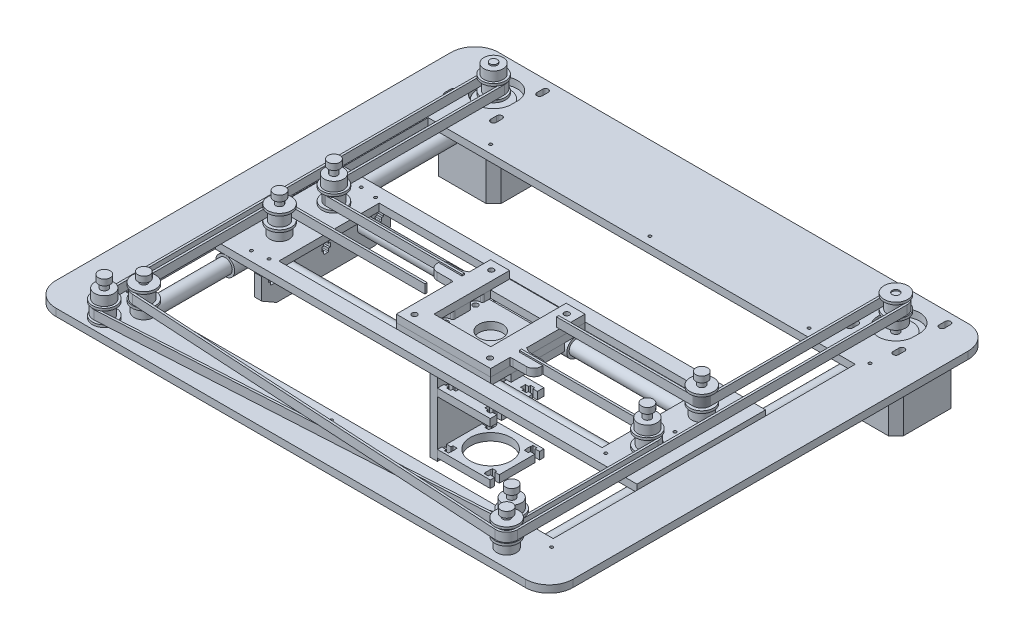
SolidWorks part; units mm, degrees
ref_plane "Front Plane" through (0, 0, 0) normal (0, 0, 1) x (1, 0, 0)
ref_plane "Top Plane" through (0, 0, 0) normal (0, 1, 0) x (1, 0, 0)
ref_plane "Right Plane" through (0, 0, 0) normal (1, 0, 0) x (0, 0, -1)
sketch "Sketch1" plane through (0, 0, 0) normal (0, 1, 0) x (1, 0, 0)
  line L0 (0, 101.6) -> (0, -101.6) construction
  line L1 (-143.7, 101.6) -> (143.7, 101.6)
  line L2 (-143.7, 101.6) -> (-143.7, -101.6)
  line L3 (-143.7, -101.6) -> (143.7, -101.6)
  line L4 (143.7, 101.6) -> (143.7, -101.6)
  line L5 (-143.7, 0) -> (143.7, 0) construction
  line L6 (-135.35, 158.3) -> (-135.35, 116.3) construction
  line L7 (-31.75, 31.75) -> (31.75, 31.75)
  line L8 (-31.75, 31.75) -> (-31.75, -31.75)
  line L9 (-31.75, -31.75) -> (31.75, -31.75)
  line L10 (31.75, 31.75) -> (31.75, -31.75)
  line L11 (-156.35, 158.3) -> (-114.35, 158.3)
  line L12 (-156.35, 158.3) -> (-156.35, 116.3)
  line L13 (-156.35, 116.3) -> (-114.35, 116.3)
  line L14 (-114.35, 158.3) -> (-114.35, 116.3)
  line L15 (-156.35, 137.3) -> (-114.35, 137.3) construction
  line L16 (-129.55, 137.3) -> (-129.55, -109.6) construction
  line L17 (-150.85, 152.8) -> (-119.85, 152.8) construction
  line L18 (-150.85, 152.8) -> (-150.85, 121.8) construction
  line L19 (-150.85, 121.8) -> (-119.85, 121.8) construction
  line L20 (-119.85, 152.8) -> (-119.85, 121.8) construction
  line L21 (-141.15, 137.3) -> (-141.15, -124.6) construction
  line L22 (-123.75, 12.5) -> (-31.75, 12.5)
  line L23 (-123.75, -12.5) -> (-31.75, -12.5)
  line L24 (-135.35, 114.3) -> (-135.35, -114.3) construction
  line L25 (-140.1125, 114.3) -> (-130.5875, 114.3)
  line L26 (-140.1125, 114.3) -> (-140.1125, -114.3)
  line L27 (-140.1125, -114.3) -> (-130.5875, -114.3)
  line L28 (-130.5875, 114.3) -> (-130.5875, -114.3)
  line L29 (-127, 25.8125) -> (127, 25.8125) construction
  line L30 (-141.7, 64.7344) -> (-129, 64.7344)
  line L31 (-141.7, 64.7344) -> (-141.7, 51.3835)
  line L32 (-141.7, 51.3835) -> (-129, 51.3835)
  line L33 (-129, 64.7344) -> (-129, 51.3835)
  line L34 (-127, 30.575) -> (127, 30.575)
  line L35 (-127, 30.575) -> (-127, 21.05)
  line L36 (-127, 21.05) -> (127, 21.05)
  line L37 (127, 30.575) -> (127, 21.05)
  line L38 (-115.75, 43.275) -> (-115.75, -43.275) construction
  line L39 (-108.75, 33.75) -> (108.75, 33.75)
  line L40 (-108.75, 33.75) -> (-108.75, -33.75)
  line L41 (-108.75, -33.75) -> (108.75, -33.75)
  line L42 (108.75, 33.75) -> (108.75, -33.75)
  line L43 (-141.7, 43.275) -> (141.7, 43.275)
  line L44 (-141.7, 43.275) -> (-141.7, -43.275)
  line L45 (-141.7, -43.275) -> (141.7, -43.275)
  line L46 (141.7, 43.275) -> (141.7, -43.275)
  line L48 (-174, 163.3) -> (174, 163.3)
  line L49 (-174, 163.3) -> (-174, -134.6)
  line L50 (-174, -134.6) -> (174, -134.6)
  line L51 (174, 163.3) -> (174, -134.6)
  circle A0 centre (-150.85, 152.8) radius 1.5
  circle A1 centre (-119.85, 152.8) radius 1.5
  circle A2 centre (-119.85, 121.8) radius 1.5
  circle A3 centre (-150.85, 121.8) radius 1.5
  circle A4 centre (-135.35, 137.3) radius 5.8
  circle A5 centre (-135.35, 137.3) radius 8
  circle A6 centre (-123.75, -109.6) radius 5.8
  circle A7 centre (-123.75, -109.6) radius 8
  circle A8 centre (-123.75, 18.3) radius 8
  circle A9 centre (-123.75, -18.3) radius 8
  circle A10 centre (-123.75, 18.3) radius 5.8
  circle A11 centre (-123.75, -18.3) radius 5.8
  circle A12 centre (-135.35, -124.6) radius 5.8
  circle A13 centre (-135.35, -124.6) radius 8
  circle A14 centre (0, 0) radius 19.05
  point P84 (-135.35, -132.6)
  point P85 (0, 19.05)
  point P86 (0, 21.05)
  dimension "D6" = 3
  dimension "D7" = 11.6
  dimension "D8" = 16
  dimension "D14" = 38.1
  dimension "D3" = 63.5
  dimension "D4" = 42
  dimension "D5" = 31
  dimension "D9" = 12.7
  dimension "D10" = 9.525
  dimension "D11" = 12.7
  dimension "D12" = 2
  dimension "D13" = 9.525
  dimension "D15" = 2
  dimension "D16" = 2
  dimension "D17" = 254
  dimension "D18" = 228.6
  dimension "D19" = 2
  dimension "D20" = 9.525
  dimension "D21" = 7
  dimension "D22" = 77
  dimension "D23" = 58.325
  dimension "D24" = 2
  dimension "D25" = 5
  dimension "D26" = 15
  dimension "D27" = 25
  dimension "D28" = 348
  dimension "D29" = 2
sketch "Sketch2" plane through (0, 0, 0) normal (0, 1, 0) x (1, 0, 0)
  line L1 (-174, 163.3) -> (174, 163.3)
  line L2 (-174, 163.3) -> (-174, -134.6)
  line L3 (-174, -134.6) -> (174, -134.6)
  line L4 (174, 163.3) -> (174, -134.6)
  line L5 (-143.7, 101.6) -> (143.7, 101.6)
  line L6 (-143.7, 101.6) -> (-143.7, -101.6)
  line L7 (-143.7, -101.6) -> (143.7, -101.6)
  line L8 (143.7, 101.6) -> (143.7, -101.6)
extrude "Extrude1" add sketch "Sketch2" along normal blind 4.9
sketch "Sketch3" plane through (0, 0, 0) normal (0, -1, 0) x (1, 0, 0)
  line L0 (-156.35, -158.3) -> (-114.35, -158.3) construction
  line L1 (-114.35, -158.3) -> (-114.35, -116.3) construction
  line L2 (-156.35, -116.3) -> (-114.35, -116.3) construction
  line L3 (-156.35, -158.3) -> (-156.35, -116.3) construction
  line L4 (-151.35, -158.3) -> (-119.35, -158.3)
  line L5 (-114.35, -153.3) -> (-114.35, -121.3)
  line L6 (-151.35, -116.3) -> (-119.35, -116.3)
  line L7 (-156.35, -153.3) -> (-156.35, -121.3)
  line L8 (-156.35, -121.3) -> (-151.35, -116.3)
  line L9 (-119.35, -116.3) -> (-114.35, -121.3)
  line L10 (-119.35, -158.3) -> (-114.35, -153.3)
  line L11 (-151.35, -158.3) -> (-156.35, -153.3)
  circle A0 centre (-150.85, -152.8) radius 1.5 construction
  circle A1 centre (-119.85, -152.8) radius 1.5 construction
  circle A2 centre (-119.85, -121.8) radius 1.5 construction
  circle A3 centre (-150.85, -121.8) radius 1.5 construction
  circle A4 centre (-150.85, -152.8) radius 1.5
  circle A5 centre (-119.85, -152.8) radius 1.5
  circle A6 centre (-119.85, -121.8) radius 1.5
  circle A7 centre (-150.85, -121.8) radius 1.5
  dimension "D3" = 5
  dimension "D4" = 5
  dimension "D5" = 5
  dimension "D6" = 5
extrude "Extrude2" add sketch "Sketch3" along normal blind 40.386 separate body
sketch "Sketch5" plane through (0, 0, 0) normal (0, 1, 0) x (1, 0, 0)
  circle A0 centre (-135.35, 137.3) radius 11
  dimension "D1" = 22
extrude "Extrude3" add sketch "Sketch5" along normal blind 1.9812
sketch "Sketch6" plane through (0, 1.9812, 0) normal (0, 1, 0) x (1, 0, 0)
  line L0 (-156.35, 137.3) -> (-114.35, 137.3) construction
  circle A0 centre (-135.35, 137.3) radius 2.5
  dimension "D1" = 5
extrude "Extrude4" add sketch "Sketch6" along normal offset from surface (21.8948 mm away) 23.876
mirror "Mirror1" about plane through (0, 0, 0) normal (1, 0, 0)
sketch "Sketch4" plane through (0, 4.9, 0) normal (0, 1, 0) x (1, 0, 0)
  line L0 (-150.85, 152.8) -> (-150.85, 156.8) construction
  line L1 (-152.725, 152.8) -> (-152.725, 156.8)
  line L2 (-148.975, 152.8) -> (-148.975, 156.8)
  line L3 (-119.85, 152.8) -> (-119.85, 156.8) construction
  line L4 (-121.725, 152.8) -> (-121.725, 156.8)
  line L5 (-117.975, 152.8) -> (-117.975, 156.8)
  line L6 (-150.85, 121.8) -> (-150.85, 125.8) construction
  line L7 (-152.725, 121.8) -> (-152.725, 125.8)
  line L8 (-148.975, 121.8) -> (-148.975, 125.8)
  line L9 (-119.85, 121.8) -> (-119.85, 125.8) construction
  line L10 (-121.725, 121.8) -> (-121.725, 125.8)
  line L11 (-117.975, 121.8) -> (-117.975, 125.8)
  line L12 (-135.35, 137.3) -> (-135.35, 141.3) construction
  line L13 (-147.35, 137.3) -> (-147.35, 141.3)
  line L14 (-123.35, 137.3) -> (-123.35, 141.3)
  line L15 (119.85, 152.8) -> (119.85, 156.8) construction
  line L16 (117.975, 152.8) -> (117.975, 156.8)
  line L17 (121.725, 152.8) -> (121.725, 156.8)
  line L18 (150.85, 152.8) -> (150.85, 156.8) construction
  line L19 (148.975, 152.8) -> (148.975, 156.8)
  line L20 (152.725, 152.8) -> (152.725, 156.8)
  line L21 (150.85, 121.8) -> (150.85, 125.8) construction
  line L22 (148.975, 121.8) -> (148.975, 125.8)
  line L23 (152.725, 121.8) -> (152.725, 125.8)
  line L24 (119.85, 121.8) -> (119.85, 125.8) construction
  line L25 (117.975, 121.8) -> (117.975, 125.8)
  line L26 (121.725, 121.8) -> (121.725, 125.8)
  line L27 (135.35, 137.3) -> (135.35, 141.3) construction
  line L28 (123.35, 137.3) -> (123.35, 141.3)
  line L29 (147.35, 137.3) -> (147.35, 141.3)
  arc A0 (-152.725, 152.8) -> (-148.975, 152.8) centre (-150.85, 152.8) ccw
  arc A1 (-148.975, 156.8) -> (-152.725, 156.8) centre (-150.85, 156.8) ccw
  arc A2 (-121.725, 152.8) -> (-117.975, 152.8) centre (-119.85, 152.8) ccw
  arc A3 (-117.975, 156.8) -> (-121.725, 156.8) centre (-119.85, 156.8) ccw
  arc A4 (-152.725, 121.8) -> (-148.975, 121.8) centre (-150.85, 121.8) ccw
  arc A5 (-148.975, 125.8) -> (-152.725, 125.8) centre (-150.85, 125.8) ccw
  arc A6 (-121.725, 121.8) -> (-117.975, 121.8) centre (-119.85, 121.8) ccw
  arc A7 (-117.975, 125.8) -> (-121.725, 125.8) centre (-119.85, 125.8) ccw
  arc A8 (-147.35, 137.3) -> (-123.35, 137.3) centre (-135.35, 137.3) ccw
  arc A9 (-123.35, 141.3) -> (-147.35, 141.3) centre (-135.35, 141.3) ccw
  arc A10 (117.975, 152.8) -> (121.725, 152.8) centre (119.85, 152.8) ccw
  arc A11 (121.725, 156.8) -> (117.975, 156.8) centre (119.85, 156.8) ccw
  arc A12 (148.975, 152.8) -> (152.725, 152.8) centre (150.85, 152.8) ccw
  arc A13 (152.725, 156.8) -> (148.975, 156.8) centre (150.85, 156.8) ccw
  arc A14 (148.975, 121.8) -> (152.725, 121.8) centre (150.85, 121.8) ccw
  arc A15 (152.725, 125.8) -> (148.975, 125.8) centre (150.85, 125.8) ccw
  arc A16 (117.975, 121.8) -> (121.725, 121.8) centre (119.85, 121.8) ccw
  arc A17 (121.725, 125.8) -> (117.975, 125.8) centre (119.85, 125.8) ccw
  arc A18 (123.35, 137.3) -> (147.35, 137.3) centre (135.35, 137.3) ccw
  arc A19 (147.35, 141.3) -> (123.35, 141.3) centre (135.35, 141.3) ccw
  point P3 (-150.85, 154.8)
  point P10 (-119.85, 154.8)
  point P21 (-150.85, 123.8)
  point P34 (-119.85, 123.8)
  point P45 (-135.35, 139.3)
  point P50 (119.85, 154.8)
  point P58 (150.85, 154.8)
  point P66 (150.85, 123.8)
  point P74 (119.85, 123.8)
  point P82 (135.35, 139.3)
  dimension "D1" = 3.75
  dimension "D2" = 4
  dimension "D3" = 24
extrude "Extrude5" cut sketch "Sketch4" against normal through all
sketch "Sketch7" plane through (0, 0, 0) normal (0, 0, 1) x (1, 0, 0)
  line L0 (-140.1125, 0) -> (-130.5875, 0) construction
  line L1 (-140.1125, 0) -> (-130.5875, 0) construction
  line L2 (0, 0) -> (0, 47.5077) construction
  line L3 (-135.35, 0) -> (-135.35, -4.7625) construction
  line L4 (-174, 0) -> (174, 0) construction
  circle A0 centre (-135.35, -4.7625) radius 4.7625
  circle A1 centre (135.35, -4.7625) radius 4.7625
  dimension "D1" = 9.525
  dimension "D2" = 4.7625
extrude "Extrude6" add sketch "Sketch7" along normal mid plane 228.6 separate body
sketch "Sketch8" plane through (0, 0, 0) normal (0, 0, 1) x (1, 0, 0)
  circle A0 centre (135.35, -4.7625) radius 6.35
  circle A1 centre (135.35, -4.7625) radius 4.7625 construction
  circle A2 centre (135.35, -4.7625) radius 4.7625
  dimension "D1" = 12.7
extrude "Extrude7" add sketch "Sketch8" along normal mid plane 12.7 separate body
sketch "Sketch9" plane through (0, 0, 6.35) normal (0, 0, 1) x (1, 0, 0)
  line L0 (135.35, -4.7625) -> (135.35, 1.5875) construction
  circle A0 centre (135.35, -4.7625) radius 6.35 construction
ref_plane "Plane1" through (0, 1.5875, 0) normal (0, 1, 0) x (-1, 0, 0)
sketch "Sketch10" plane through (0, 1.5875, 0) normal (0, 1, 0) x (-1, 0, 0)
  line L0 (141.7, -43.275) -> (141.7, 43.275) construction
  line L1 (141.7, -43.275) -> (-141.7, -43.275) construction
  line L2 (-141.7, -43.275) -> (-141.7, 43.275) construction
  line L3 (141.7, 43.275) -> (-141.7, 43.275) construction
  line L4 (141.7, -43.275) -> (141.7, 43.275)
  line L5 (141.7, -43.275) -> (-141.7, -43.275)
  line L6 (-141.7, -43.275) -> (-141.7, 43.275)
  line L7 (141.7, 43.275) -> (-141.7, 43.275)
  line L8 (108.75, -33.75) -> (108.75, 33.75) construction
  line L9 (108.75, -33.75) -> (-108.75, -33.75) construction
  line L10 (-108.75, -33.75) -> (-108.75, 33.75) construction
  line L11 (108.75, 33.75) -> (-108.75, 33.75) construction
  line L12 (108.75, -33.75) -> (108.75, 33.75)
  line L13 (108.75, -33.75) -> (-108.75, -33.75)
  line L14 (-108.75, -33.75) -> (-108.75, 33.75)
  line L15 (108.75, 33.75) -> (-108.75, 33.75)
extrude "Extrude8" add sketch "Sketch10" along normal blind 4.9 separate body
sketch "Sketch11" plane through (0, 0, 43.275) normal (0, 0, 1) x (1, 0, 0)
  circle A0 centre (-135.35, -4.7625) radius 6.35
  circle A1 centre (-135.35, -4.7625) radius 4.7625 construction
  circle A2 centre (-135.35, -4.7625) radius 4.7625
  dimension "D1" = 12.7
extrude "Extrude9" add sketch "Sketch11" against normal blind 12.7 separate body
sketch "Sketch12" plane through (0, 0, -43.275) normal (0, 0, -1) x (-1, 0, 0)
  circle A0 centre (135.35, -4.7625) radius 4.7625 construction
  circle A1 centre (135.35, -4.7625) radius 6.35
  circle A2 centre (135.35, -4.7625) radius 6.35
  circle A3 centre (135.35, -4.7625) radius 4.7625
  dimension "D1" = 0
extrude "Extrude10" add sketch "Sketch12" against normal blind 12.7 separate body
sketch "Sketch13" plane through (0, 0, 0) normal (1, 0, 0) x (0, 0, -1)
  line L0 (30.575, 0) -> (21.05, 0) construction
  line L1 (30.575, 0) -> (21.05, 0) construction
  line L2 (25.8125, 0) -> (25.8125, -25.9169) construction
  line L3 (-33.75, 1.5875) -> (33.75, 1.5875) construction
  line L4 (0, 0) -> (0, 47.9964) construction
  line L5 (43.275, 0) -> (-43.275, 0) construction
  circle A0 centre (25.8125, -3.175) radius 4.7625
  circle A1 centre (-25.8125, -3.175) radius 4.7625
  dimension "D1" = 9.525
  dimension "D2" = 4.7625
extrude "Extrude11" add sketch "Sketch13" along normal mid plane 254 separate body
sketch "Sketch14" plane through (0, 0, 0) normal (1, 0, 0) x (0, 0, -1)
  circle A1 centre (-25.8125, -3.175) radius 6.35
  circle A2 centre (-25.8125, -3.175) radius 4.7625
  circle A3 centre (-25.8125, -3.175) radius 4.7625
  dimension "D3" = 12.7
  dimension "D1" = 0
extrude "Extrude12" add sketch "Sketch14" along normal mid plane 12.7 separate body
sketch "Sketch15" plane through (6.35, 0, 0) normal (1, 0, 0) x (0, 0, -1)
  line L0 (-25.8125, -3.175) -> (-25.8125, 3.175) construction
  circle A0 centre (-25.8125, -3.175) radius 6.35 construction
  circle A1 centre (-25.8125, -3.175) radius 6.35 construction
ref_plane "Plane2" through (0, 3.175, 0) normal (0, 1, 0) x (-1, 0, 0)
sketch "Sketch16" plane through (0, 3.175, 0) normal (0, 1, 0) x (-1, 0, 0)
  line L0 (31.75, -31.75) -> (-31.75, -31.75) construction
  line L1 (31.75, -31.75) -> (31.75, 31.75) construction
  line L2 (31.75, 31.75) -> (-31.75, 31.75) construction
  line L3 (-31.75, -31.75) -> (-31.75, 31.75) construction
  line L4 (31.75, -31.75) -> (-31.75, -31.75)
  line L5 (31.75, -31.75) -> (31.75, 31.75)
  line L6 (31.75, 31.75) -> (-31.75, 31.75)
  line L7 (-31.75, -31.75) -> (-31.75, 31.75)
  line L9 (-19.05, 19.05) -> (19.05, 19.05)
  line L10 (-19.05, 19.05) -> (-19.05, -19.05)
  line L11 (-19.05, -19.05) -> (19.05, -19.05)
  line L12 (19.05, 19.05) -> (19.05, -19.05)
  circle A0 centre (0, 0) radius 19.05 construction
  circle A1 centre (0, 0) radius 19.05 construction
extrude "Extrude13" add sketch "Sketch16" along normal blind 4.9 separate body
sketch "Sketch17" plane through (31.75, 0, 0) normal (1, 0, 0) x (0, 0, -1)
  circle A0 centre (25.8125, -3.175) radius 4.7625 construction
  circle A1 centre (25.8125, -3.175) radius 4.7625
  circle A2 centre (25.8125, -3.175) radius 6.35
  dimension "D1" = 12.7
extrude "Extrude14" add sketch "Sketch17" against normal blind 12.7 separate body
sketch "Sketch18" plane through (-31.75, 0, 0) normal (-1, 0, 0) x (0, 0, 1)
  circle A0 centre (-25.8125, -3.175) radius 6.35 construction
  circle A1 centre (-25.8125, -3.175) radius 6.35
  circle A2 centre (-25.8125, -3.175) radius 4.7625 construction
  circle A3 centre (-25.8125, -3.175) radius 4.7625
extrude "Extrude15" add sketch "Sketch18" against normal blind 12.7 separate body
sketch "Sketch19" plane through (0, 6.4875, 0) normal (0, 1, 0) x (1, 0, 0)
  line L1 (0, 43.275) -> (0, -43.275) construction
  line L2 (-141.7, 43.275) -> (141.7, 43.275) construction
  line L3 (-141.7, -43.275) -> (141.7, -43.275) construction
  circle A0 centre (-123.75, 18.3) radius 1
  circle A1 centre (-123.75, -18.3) radius 1
  circle A2 centre (123.75, -18.3) radius 1
  circle A3 centre (123.75, 18.3) radius 1
  dimension "D1" = 2
extrude "Extrude16" cut sketch "Sketch19" against normal through all
sketch "Sketch20" plane through (0, 6.4875, 0) normal (0, 1, 0) x (1, 0, 0)
  circle A0 centre (-123.75, 18.3) radius 2.5
  circle A1 centre (-123.75, -18.3) radius 2.5
  circle A2 centre (123.75, 18.3) radius 2.5
  circle A3 centre (123.75, -18.3) radius 2.5
  dimension "D1" = 5
extrude "Extrude17" add sketch "Sketch20" along normal blind 22 separate body
sketch "Sketch21" plane through (0, 28.4875, 0) normal (0, 1, 0) x (1, 0, 0)
  circle A0 centre (-123.75, 18.3) radius 4
  circle A1 centre (-123.75, -18.3) radius 4
  circle A2 centre (123.75, 18.3) radius 4
  circle A3 centre (123.75, -18.3) radius 4
  dimension "D1" = 8
extrude "Extrude18" add sketch "Sketch21" along normal blind 4
sketch "Sketch22" plane through (0, 6.4875, 0) normal (0, 1, 0) x (1, 0, 0)
  circle A0 centre (-123.75, 18.3) radius 2.5
  circle A1 centre (-123.75, 18.3) radius 8
  dimension "D1" = 5
  dimension "D2" = 16
extrude "Extrude19" add sketch "Sketch22" along normal blind 1.6 separate body
sketch "Sketch23" plane through (0, 8.0875, 0) normal (0, 1, 0) x (1, 0, 0)
  circle A0 centre (-123.75, 18.3) radius 2.5 construction
  circle A1 centre (-123.75, 18.3) radius 2.5
  circle A2 centre (-123.75, 18.3) radius 5.8
  dimension "D1" = 11.6
extrude "Extrude20" add sketch "Sketch23" along normal blind 8
sketch "Sketch24" plane through (0, 16.0875, 0) normal (0, 1, 0) x (1, 0, 0)
  circle A0 centre (-123.75, 18.3) radius 2.5 construction
  circle A1 centre (-123.75, 18.3) radius 8
  circle A2 centre (-123.75, 18.3) radius 8
  circle A3 centre (-123.75, 18.3) radius 2.5
  dimension "D1" = 0
extrude "Extrude21" add sketch "Sketch24" along normal blind 1.6
sketch "Sketch25" plane through (0, 17.6875, 0) normal (0, 1, 0) x (1, 0, 0)
  circle A0 centre (-123.75, 18.3) radius 2.5 construction
  circle A1 centre (-123.75, 18.3) radius 2.5
  circle A2 centre (-123.75, 18.3) radius 6.5
  dimension "D1" = 13
extrude "Extrude22" add sketch "Sketch25" along normal offset from surface (6.3 mm away) 17.5
sketch "Sketch26" plane through (0, 4.9, 0) normal (0, 1, 0) x (1, 0, 0)
  line L1 (0, -101.6) -> (0, 0) construction
  line L2 (-143.7, -101.6) -> (143.7, -101.6) construction
  circle A0 centre (-123.75, -109.6) radius 1
  circle A1 centre (-135.35, -124.6) radius 1
  circle A2 centre (135.35, -124.6) radius 1
  circle A3 centre (123.75, -109.6) radius 1
  dimension "D1" = 2
extrude "Extrude23" cut sketch "Sketch26" against normal through all
sketch "Sketch27" plane through (0, 4.9, 0) normal (0, 1, 0) x (1, 0, 0)
  circle A0 centre (-123.75, -109.6) radius 2.5
  circle A1 centre (-135.35, -124.6) radius 2.5
  circle A2 centre (123.75, -109.6) radius 2.5
  circle A3 centre (135.35, -124.6) radius 2.5
  dimension "D1" = 5
extrude "Extrude24" add sketch "Sketch27" along normal blind 22 separate body
sketch "Sketch28" plane through (0, 26.9, 0) normal (0, 1, 0) x (1, 0, 0)
  circle A0 centre (-123.75, -109.6) radius 4
  circle A1 centre (-135.35, -124.6) radius 4
  circle A2 centre (123.75, -109.6) radius 4
  circle A3 centre (135.35, -124.6) radius 4
  dimension "D1" = 8
extrude "Extrude25" add sketch "Sketch28" along normal blind 4
move or copy body "Body-Move/Copy1" bodies to move or copy 131
move or copy body "Body-Move/Copy2" bodies to move or copy 141 placed by mates yes
other "Distance2" parameters "D1"=7
move or copy body "Body-Move/Copy3" bodies to move or copy 142 placed by mates yes
move or copy body "Body-Move/Copy4" bodies to move or copy 143 placed by mates yes
move or copy body "Body-Move/Copy5" bodies to move or copy 144 placed by mates yes
move or copy body "Body-Move/Copy6" bodies to move or copy 145 placed by mates yes
other "Distance3" parameters "D1"=7
move or copy body "Body-Move/Copy7" bodies to move or copy 146 placed by mates yes
move or copy body "Body-Move/Copy8" bodies to move or copy 147 placed by mates yes
move or copy body "Body-Move/Copy9" bodies to move or copy 148 placed by mates yes
move or copy body "Body-Move/Copy10" bodies to move or copy 149 placed by mates yes
sketch "Sketch29" plane through (0, 8.0875, 0) normal (0, 1, 0) x (1, 0, 0)
  line L0 (-129.55, 137.3) -> (-129.55, 18.3)
  line L1 (-123.75, 12.5) -> (-31.75, 12.5)
  line L2 (-141.15, 137.3) -> (-141.15, -124.6)
  line L3 (-135.0148, -130.3903) -> (124.0852, -115.3903)
  line L4 (129.55, -18.3) -> (129.55, -109.6)
  line L5 (123.75, -12.5) -> (31.75, -12.5)
  line L6 (31.75, 31.75) -> (31.75, -31.75) construction
  line L7 (-135.35, 158.3) -> (-135.35, 116.3) construction
  line L8 (-156.35, 137.3) -> (-114.35, 137.3) construction
  line L9 (-123.75, 14) -> (-31.75, 14)
  line L11 (-128.05, 137.3) -> (-128.05, 18.3)
  line L12 (-142.65, 137.3) -> (-142.65, -124.6)
  line L13 (-134.9281, -131.8878) -> (124.1719, -116.8878)
  line L14 (131.05, -18.3) -> (131.05, -109.6)
  line L15 (123.75, -11) -> (31.75, -11)
  line L16 (-31.75, 14) -> (-31.75, 12.5)
  line L17 (31.75, -11) -> (31.75, -12.5)
  circle A0 centre (-123.75, 18.3) radius 5.8 construction
  circle A1 centre (-135.35, -124.6) radius 5.8 construction
  circle A2 centre (123.75, -109.6) radius 5.8 construction
  circle A3 centre (123.75, -18.3) radius 5.8 construction
  circle A4 centre (-135.35, -124.6) radius 5.8 construction
  arc A5 (-141.15, 137.3) -> (-129.55, 137.3) centre (-135.35, 137.3) cw
  arc A6 (-129.55, 18.3) -> (-123.75, 12.5) centre (-123.75, 18.3) ccw
  arc A7 (-141.15, -124.6) -> (-135.0148, -130.3903) centre (-135.35, -124.6) ccw
  arc A8 (124.0852, -115.3903) -> (129.55, -109.6) centre (123.75, -109.6) ccw
  arc A9 (129.55, -18.3) -> (123.75, -12.5) centre (123.75, -18.3) ccw
  arc A10 (-128.05, 18.3) -> (-123.75, 14) centre (-123.75, 18.3) ccw
  arc A11 (-142.65, 137.3) -> (-128.05, 137.3) centre (-135.35, 137.3) cw
  arc A12 (-142.65, -124.6) -> (-134.9281, -131.8878) centre (-135.35, -124.6) ccw
  arc A13 (124.1719, -116.8878) -> (131.05, -109.6) centre (123.75, -109.6) ccw
  arc A14 (131.05, -18.3) -> (123.75, -11) centre (123.75, -18.3) ccw
  dimension "D1" = 1.5
extrude "Extrude26" add sketch "Sketch29" along normal blind 6 separate body
sketch "Sketch30" plane through (0, 15.0875, 0) normal (0, 1, 0) x (1, 0, 0)
  line L0 (129.55, 137.3) -> (129.55, 18.3)
  line L1 (123.75, 12.5) -> (31.75, 12.5)
  line L2 (31.75, 31.75) -> (31.75, -31.75) construction
  line L3 (141.15, 137.3) -> (141.15, -124.6)
  line L4 (135.0148, -130.3903) -> (-124.0852, -115.3903)
  line L5 (-129.55, -109.6) -> (-129.55, -18.3)
  line L6 (-129.55, 137.3) -> (-129.55, -109.6) construction
  line L7 (-123.75, -12.5) -> (-31.75, -12.5)
  line L8 (-123.75, -11) -> (-31.75, -11)
  line L9 (-131.05, -109.6) -> (-131.05, -18.3)
  line L10 (134.9281, -131.8878) -> (-124.1719, -116.8878)
  line L11 (142.65, 137.3) -> (142.65, -124.6)
  line L12 (128.05, 137.3) -> (128.05, 18.3)
  line L13 (123.75, 14) -> (31.75, 14)
  line L14 (-31.75, -11) -> (-31.75, -12.5)
  line L15 (31.75, 14) -> (31.75, 12.5)
  circle A0 centre (135.35, 137.3) radius 5.8 construction
  circle A1 centre (123.75, 18.3) radius 5.8 construction
  circle A2 centre (135.35, -124.6) radius 5.8 construction
  circle A3 centre (-123.75, -109.6) radius 5.8 construction
  circle A4 centre (-123.75, -18.3) radius 5.8 construction
  circle A5 centre (-123.75, -109.6) radius 5.8 construction
  arc A6 (141.15, 137.3) -> (129.55, 137.3) centre (135.35, 137.3) ccw
  arc A7 (123.75, 12.5) -> (129.55, 18.3) centre (123.75, 18.3) ccw
  arc A8 (135.0148, -130.3903) -> (141.15, -124.6) centre (135.35, -124.6) ccw
  arc A9 (-124.0852, -115.3903) -> (-129.55, -109.6) centre (-123.75, -109.6) cw
  arc A10 (-129.55, -18.3) -> (-123.75, -12.5) centre (-123.75, -18.3) cw
  arc A11 (-131.05, -18.3) -> (-123.75, -11) centre (-123.75, -18.3) cw
  arc A12 (-124.1719, -116.8878) -> (-131.05, -109.6) centre (-123.75, -109.6) cw
  arc A13 (134.9281, -131.8878) -> (142.65, -124.6) centre (135.35, -124.6) ccw
  arc A14 (142.65, 137.3) -> (128.05, 137.3) centre (135.35, 137.3) ccw
  arc A15 (123.75, 14) -> (128.05, 18.3) centre (123.75, 18.3) ccw
  dimension "D1" = 1.5
extrude "Extrude28" add sketch "Sketch30" along normal blind 6 separate body
fillet "Fillet1" radius 16 4 edges at (174, 2.45, -163.3) (174, 2.45, 134.6) (-174, 2.45, 134.6) (-174, 2.45, -163.3)
sketch "Sketch31" plane through (0, 0, 0) normal (0, -1, 0) x (1, 0, 0)
  line L0 (0, 134.6) -> (0, -163.3) construction
  line L1 (-155.1125, 109.6) -> (155.1125, 109.6) construction
  line L2 (-155.1125, 109.6) -> (-155.1125, 104.6) construction
  line L3 (-155.1125, 104.6) -> (155.1125, 104.6) construction
  line L4 (155.1125, 109.6) -> (155.1125, 104.6) construction
  line L5 (-158, 134.6) -> (158, 134.6) construction
  line L6 (158, -163.3) -> (-158, -163.3) construction
  line L7 (-143.7, 101.6) -> (143.7, 101.6) construction
  line L8 (-140.1125, 114.3) -> (-140.1125, -114.3) construction
  line L9 (-155.1125, 107.1) -> (155.1125, 107.1) construction
  line L10 (-143.7, 0) -> (143.7, 0) construction
  line L11 (-143.7, -101.6) -> (-143.7, 101.6) construction
  line L12 (143.7, 101.6) -> (143.7, -101.6) construction
  circle A0 centre (-148.1125, 107.1) radius 1
  circle A1 centre (-107.1125, 107.1) radius 1
  circle A2 centre (0, 107.1) radius 1
  circle A3 centre (107.1125, 107.1) radius 1
  circle A4 centre (148.1125, 107.1) radius 1
  circle A5 centre (148.1125, -107.1) radius 1
  circle A6 centre (107.1125, -107.1) radius 1
  circle A7 centre (0, -107.1) radius 1
  circle A8 centre (-107.1125, -107.1) radius 1
  circle A9 centre (-148.1125, -107.1) radius 1
  circle A10 centre (-148.1125, 107.1) radius 3 construction
  dimension "D4" = 2
  dimension "D7" = 6
  dimension "D1" = 5
  dimension "D2" = 3
  dimension "D3" = 15
  dimension "D5" = 7
  dimension "D6" = 48
extrude "Extrude29" cut sketch "Sketch31" against normal through all
sketch "Sketch32" plane through (0, 1.5875, 0) normal (0, -1, 0) x (1, 0, 0)
  line L0 (0, 43.275) -> (0, -43.275) construction
  line L1 (-141.7, 43.275) -> (141.7, 43.275) construction
  line L2 (141.7, -43.275) -> (-141.7, -43.275) construction
  line L3 (-108.75, -33.75) -> (-108.75, 33.75) construction
  line L4 (-115.75, 43.275) -> (-110.75, 43.275) construction
  line L5 (-115.75, 43.275) -> (-115.75, -43.275) construction
  line L6 (-115.75, -43.275) -> (-110.75, -43.275) construction
  line L7 (-110.75, 43.275) -> (-110.75, -43.275) construction
  line L8 (-113.25, 43.275) -> (-113.25, -43.275) construction
  line L9 (-108.75, 0) -> (108.75, 0) construction
  line L10 (108.75, 33.75) -> (108.75, -33.75) construction
  line L15 (-127, 25.8125) -> (-102.3276, 25.8125) construction
  line L16 (-127, 30.575) -> (-127, 21.05) construction
  line L17 (-141.7, -36.925) -> (-124.05, -36.925) construction
  line L18 (-141.7, -30.575) -> (-141.7, -43.275) construction
  line L19 (-128.05, -18.3) -> (-128.05, -137.3) construction
  line L20 (-141.7, -34.425) -> (-116.7, -34.425) construction
  line L21 (-141.7, -34.425) -> (-141.7, -39.425) construction
  line L22 (-141.7, -39.425) -> (-116.7, -39.425) construction
  line L23 (-116.7, -34.425) -> (-116.7, -39.425) construction
  line L25 (124.05, 0) -> (141.7, 0) construction
  line L26 (141.7, 43.275) -> (141.7, -43.275) construction
  circle A0 centre (-113.25, 0) radius 1
  circle A1 centre (-113.25, 35.8125) radius 1
  circle A2 centre (-113.25, 35.8125) radius 3 construction
  circle A3 centre (-113.25, 0) radius 3 construction
  circle A4 centre (-113.25, -35.8125) radius 1
  circle A6 centre (113.25, -35.8125) radius 1
  circle A8 centre (113.25, 0) radius 1
  circle A9 centre (113.25, 35.8125) radius 1
  circle A10 centre (-124.05, -36.925) radius 1
  circle A11 centre (-124.05, -36.925) radius 3 construction
  circle A12 centre (-124.05, 36.925) radius 1
  circle A13 centre (124.05, 0) radius 1
  point P53 (-127.05, -36.925)
  dimension "D3" = 6
  dimension "D5" = 2
  dimension "D6" = 6
  dimension "D7" = 2
  dimension "D1" = 5
  dimension "D2" = 2
  dimension "D4" = 10
  dimension "D8" = 1
  dimension "D9" = 25
extrude "Extrude30" cut sketch "Sketch32" against normal through all
sketch "Sketch33" plane through (0, 8.075, 0) normal (0, 1, 0) x (1, 0, 0)
  line L0 (-19.05, -19.05) -> (19.05, -19.05) construction
  line L1 (19.05, -19.05) -> (19.05, 19.05) construction
  line L2 (-19.05, 19.05) -> (-19.05, -19.05) construction
  line L4 (-31.75, 31.75) -> (-31.75, -31.75)
  line L5 (-31.75, -31.75) -> (31.75, -31.75)
  line L6 (31.75, -31.75) -> (31.75, 31.75)
  line L7 (31.75, 31.75) -> (-31.75, 31.75)
  line L8 (-31.75, 31.75) -> (-31.75, -31.75)
  line L9 (-31.75, -31.75) -> (31.75, -31.75)
  line L10 (31.75, -31.75) -> (31.75, 31.75)
  line L11 (31.75, 31.75) -> (19.05, 31.75)
  line L12 (-19.05, -19.05) -> (19.05, -19.05)
  line L13 (19.05, -19.05) -> (19.05, 19.05)
  line L14 (-19.05, 19.05) -> (-19.05, -19.05)
  line L16 (-19.05, 19.05) -> (-19.05, 31.75)
  line L17 (19.05, 19.05) -> (19.05, 31.75)
  line L18 (-19.05, 31.75) -> (-31.75, 31.75)
  dimension "D1" = 0
extrude "Extrude31" add sketch "Sketch33" along normal blind 5 separate body
sketch "Sketch34" plane through (0, 13.075, 0) normal (0, 1, 0) x (1, 0, 0)
  line L0 (-25.4, 31.75) -> (-25.4, -31.75) construction
  line L1 (-19.05, 31.75) -> (-31.75, 31.75) construction
  line L2 (-31.75, -31.75) -> (31.75, -31.75) construction
  line L3 (0, -31.75) -> (0, 31.75) construction
  line L4 (31.75, 31.75) -> (-31.75, 31.75) construction
  line L5 (-31.75, 0) -> (31.75, 0) construction
  line L6 (-31.75, 31.75) -> (-31.75, -31.75) construction
  line L7 (31.75, -31.75) -> (31.75, 31.75) construction
  line L8 (-127, 25.8125) -> (127, 25.8125) construction
  line L9 (-127, 30.575) -> (-127, 21.05) construction
  line L10 (127, 21.05) -> (127, 30.575) construction
  circle A0 centre (-25.4, 25.8125) radius 1.75
  circle A1 centre (-25.4, -25.8125) radius 1.75
  circle A2 centre (25.4, -25.8125) radius 1.75
  circle A3 centre (25.4, 25.8125) radius 1.75
  dimension "D1" = 3.5
extrude "Extrude32" cut sketch "Sketch34" against normal through all
sketch "Sketch35" plane through (0, 8.075, 0) normal (0, 1, 0) x (1, 0, 0)
  circle A0 centre (-25.4, 25.8125) radius 0.875
  circle A1 centre (25.4, 25.8125) radius 0.875
  circle A2 centre (25.4, -25.8125) radius 0.875
  circle A3 centre (-25.4, -25.8125) radius 0.875
  dimension "D1" = 1.75
extrude "Extrude33" cut sketch "Sketch35" against normal through all
sketch "Sketch36" plane through (0, 3.175, 0) normal (0, -1, 0) x (1, 0, 0)
  line L0 (0, 0) -> (0, -31.75) construction
  line L1 (-19.05, 0) -> (19.05, 0) construction
  line L2 (-19.05, -19.05) -> (-19.05, 19.05) construction
  line L3 (19.05, 19.05) -> (19.05, -19.05) construction
  line L4 (-31.75, -31.75) -> (-31.75, 31.75) construction
  line L5 (31.75, -31.75) -> (-31.75, -31.75) construction
  line L6 (-31.75, 18.05) -> (31.75, 18.05)
  line L9 (-31.75, 18.05) -> (-31.75, -18.05)
  line L10 (-31.75, -18.05) -> (31.75, -18.05)
  line L11 (31.75, 18.05) -> (31.75, -18.05)
  line L12 (31.75, 31.75) -> (31.75, -31.75) construction
  line L13 (-19.05, 19.05) -> (19.05, 19.05) construction
  circle A0 centre (0, 0) radius 7.9756
  circle A1 centre (-27.75, 10) radius 1.75
  circle A2 centre (-27.75, -10) radius 1.75
  circle A3 centre (27.75, -10) radius 1.75
  circle A4 centre (27.75, 10) radius 1.75
  dimension "D2" = 15.9512
  dimension "D3" = 3.5
  dimension "D1" = 1
  dimension "D4" = 4
  dimension "D5" = 20
extrude "Extrude34" add sketch "Sketch36" along normal blind 5 separate body
sketch "Sketch37" plane through (0, 3.175, 0) normal (0, -1, 0) x (1, 0, 0)
  circle A0 centre (-27.75, 10) radius 0.875
  circle A1 centre (27.75, 10) radius 0.875
  circle A2 centre (27.75, -10) radius 0.875
  circle A3 centre (-27.75, -10) radius 0.875
  dimension "D1" = 1.75
extrude "Extrude35" cut sketch "Sketch37" against normal through all
ref_plane "Plane5" through (0, -7.825, 0) normal (0, -1, 0) x (1, 0, 0)
sketch "Sketch38" plane through (0, -7.825, 0) normal (0, -1, 0) x (1, 0, 0)
  line L0 (31.75, 18.05) -> (-31.75, 18.05) construction
  line L1 (-22.75, 18.05) -> (-17.75, 18.05) construction
  line L2 (-22.75, 18.05) -> (-22.75, -18.05) construction
  line L3 (-22.75, -18.05) -> (-17.75, -18.05) construction
  line L4 (-17.75, 18.05) -> (-17.75, -18.05) construction
  line L5 (-31.75, -18.05) -> (31.75, -18.05) construction
  line L6 (0, 0) -> (0, 26.54) construction
  line L8 (-17.75, 18.05) -> (17.75, 18.05)
  line L9 (-17.75, 18.05) -> (-17.75, -18.05)
  line L10 (-17.75, -18.05) -> (17.75, -18.05)
  line L11 (17.75, 18.05) -> (17.75, -18.05)
  circle A0 centre (0, 0) radius 13.75 construction
  circle A1 centre (0, 0) radius 7.9756 construction
  circle A2 centre (0, 0) radius 7.9756
  point P14 (-13.75, 0)
  dimension "D1" = 27.5
  dimension "D2" = 5
  dimension "D3" = 4
extrude "Extrude36" add sketch "Sketch38" along normal blind 5 separate body
ref_plane "Plane3" through (0, -34.925, 0) normal (0, 1, 0) x (-1, 0, 0)
sketch "Sketch39" plane through (0, -34.925, 0) normal (0, 1, 0) x (-1, 0, 0)
  line L4 (-17.75, -18.05) -> (17.75, -18.05)
  line L5 (-17.75, 18.05) -> (-17.75, -18.05)
  line L6 (17.75, 18.05) -> (-17.75, 18.05)
  line L7 (17.75, -18.05) -> (17.75, 18.05)
  line L8 (-17.75, -18.05) -> (17.75, -18.05)
  line L9 (-17.75, 18.05) -> (-17.75, -18.05)
  line L10 (17.75, 18.05) -> (-17.75, 18.05)
  line L11 (17.75, -18.05) -> (17.75, 18.05)
  circle A0 centre (0, 0) radius 7.9756 construction
  circle A1 centre (0, 0) radius 7.9756
  dimension "D1" = 0
extrude "Extrude37" add sketch "Sketch39" along normal blind 5 separate body
ref_plane "Plane4" through (0, -65.659, 0) normal (0, -1, 0) x (1, 0, 0)
sketch "Sketch40" plane through (0, -65.659, 0) normal (0, -1, 0) x (1, 0, 0)
  line L4 (-17.75, 18.05) -> (-17.75, -18.05)
  line L5 (-17.75, -18.05) -> (17.75, -18.05)
  line L6 (17.75, -18.05) -> (17.75, 18.05)
  line L7 (17.75, 18.05) -> (-17.75, 18.05)
  line L8 (-17.75, 18.05) -> (-17.75, -18.05)
  line L9 (-17.75, -18.05) -> (17.75, -18.05)
  line L10 (17.75, -18.05) -> (17.75, 18.05)
  line L11 (17.75, 18.05) -> (-17.75, 18.05)
  circle A0 centre (0, 0) radius 13.716
  dimension "D2" = 27.432
  dimension "D1" = 0
extrude "Extrude38" add sketch "Sketch40" along normal blind 5 separate body
sketch "Sketch41" plane through (-17.75, 0, 0) normal (-1, 0, 0) x (0, 0, 1)
  line L0 (18.05, -70.659) -> (18.05, -65.659) construction
  line L1 (-18.05, -1.825) -> (18.05, -1.825)
  line L2 (-18.05, -1.825) -> (-18.05, -72.659)
  line L3 (-18.05, -72.659) -> (18.05, -72.659)
  line L4 (18.05, -1.825) -> (18.05, -72.659)
  line L5 (18.05, -70.659) -> (-18.05, -70.659) construction
  line L6 (0, -65.659) -> (0, -70.659) construction
  line L7 (18.05, -65.659) -> (-18.05, -65.659) construction
  line L8 (0, -34.925) -> (0, -29.925) construction
  line L9 (-18.05, -34.925) -> (18.05, -34.925) construction
  line L10 (-18.05, -29.925) -> (18.05, -29.925) construction
  line L11 (0, -12.825) -> (0, -1.825) construction
  line L12 (18.05, -12.825) -> (-18.05, -12.825) construction
  line L13 (0, -68.159) -> (-18.05, -68.159) construction
  line L14 (0, -32.425) -> (-18.05, -32.425) construction
  line L15 (0, -7.325) -> (-18.05, -7.325) construction
  line L16 (18.05, -1.825) -> (-18.05, -1.825) construction
  dimension "D1" = 2
extrude "Extrude39" add sketch "Sketch41" along normal blind 5 separate body
sketch "Sketch42" plane through (0, 3.175, 0) normal (0, 1, 0) x (1, 0, 0)
  line L0 (-22.75, 18.05) -> (-17.75, 18.05) construction
  line L1 (0, 18.05) -> (0, -18.05) construction
  line L2 (-31.75, 18.05) -> (31.75, 18.05) construction
  line L3 (31.75, -18.05) -> (-31.75, -18.05) construction
  line L4 (-20.25, 18.05) -> (-20.25, -18.05) construction
  line L5 (-22.75, 0) -> (31.75, 0) construction
  line L6 (-22.75, -18.05) -> (-22.75, 18.05) construction
  line L7 (31.75, -31.75) -> (31.75, 31.75) construction
  circle A0 centre (-20.25, 10) radius 1.75
  circle A2 centre (-20.25, -10) radius 1.75
  circle A3 centre (20.25, -10) radius 1.75
  circle A4 centre (20.25, 10) radius 1.75
  point P22 (-27.75, 10)
  dimension "D1" = 3.5
extrude "Extrude40" cut sketch "Sketch42" against normal through all
sketch "Sketch43" plane through (0, 8.075, 0) normal (0, 1, 0) x (1, 0, 0)
  circle A0 centre (-20.25, 10) radius 3.5
  circle A1 centre (-20.25, -10) radius 3.5
  circle A2 centre (20.25, -10) radius 3.5
  circle A3 centre (20.25, 10) radius 3.5
  dimension "D1" = 7
extrude "Extrude41" cut sketch "Sketch43" against normal through all
fillet "Fillet2" radius 1.5 8 edges at (-19.05, 5.625, -13.2879) (-19.05, 5.625, -6.7121) (-19.05, 5.625, 6.7121) (-19.05, 5.625, 13.2879) (19.05, 5.625, 13.2879) (19.05, 5.625, 6.7121) (19.05, 5.625, -6.7121) (19.05, 5.625, -13.2879)
ref_plane "Plane6" through (0, 0, 104.6) normal (0, 0, -1) x (-1, 0, 0)
sketch "Sketch44" plane through (0, 0, 104.6) normal (0, 0, -1) x (-1, 0, 0)
  line L0 (-133.8273, -0.25) -> (-136.8727, -0.25) construction
  line L1 (155.1125, 0) -> (-155.1125, 0) construction
  line L2 (140.1125, -4.7625) -> (140.1125, -0.25)
  line L3 (130.5875, -4.7625) -> (130.5875, -0.25)
  line L4 (-140.1125, -4.7625) -> (-140.1125, -0.25)
  line L5 (-130.5875, -4.7625) -> (-130.5875, -0.25)
  line L6 (155.1125, 0) -> (-155.1125, 0) construction
  line L8 (155.1125, -0.25) -> (140.1125, -0.25)
  line L9 (155.1125, -0.25) -> (155.1125, -20.25)
  line L10 (155.1125, -20.25) -> (-155.1125, -20.25)
  line L11 (-155.1125, -20.25) -> (-155.1125, -0.25)
  line L12 (130.5875, -0.25) -> (-130.5875, -0.25)
  line L13 (-140.1125, -0.25) -> (-155.1125, -0.25)
  circle A0 centre (135.35, -4.7625) radius 4.7625 construction
  arc A1 (136.5359, -0.15) -> (133.8273, -0.25) centre (135.35, -4.7625) ccw construction
  circle A2 centre (-135.35, -4.7625) radius 4.7625 construction
  arc A3 (-140.1125, -4.7625) -> (-130.5875, -4.7625) centre (-135.35, -4.7625) ccw
  arc A4 (130.5875, -4.7625) -> (140.1125, -4.7625) centre (135.35, -4.7625) ccw
  arc A5 (-133.8273, -0.25) -> (-136.8727, -0.25) centre (-135.35, -4.7625) ccw construction
  dimension "D1" = 0.5
  dimension "D2" = 20
extrude "Extrude42" add sketch "Sketch44" against normal blind 5 separate body
ref_plane "Plane7" through (-110.75, 0, 0) normal (1, 0, 0) x (0, 0, -1)
sketch "Sketch45" plane through (-110.75, 0, 0) normal (1, 0, 0) x (0, 0, -1)
  line L0 (-43.275, 6.4875) -> (-43.275, 1.5875) construction
  line L1 (43.275, 1.0875) -> (30.575, 1.0875)
  line L2 (43.275, 1.0875) -> (43.275, -18.9125)
  line L3 (43.275, -18.9125) -> (-43.275, -18.9125)
  line L4 (-43.275, 1.0875) -> (-43.275, -18.9125)
  line L5 (43.275, 6.4875) -> (43.275, 1.5875) construction
  line L6 (-43.275, 1.5875) -> (43.275, 1.5875) construction
  line L7 (30.575, -3.175) -> (30.575, 1.0875)
  line L8 (21.05, -3.175) -> (21.05, 1.0875)
  line L9 (21.05, 1.0875) -> (-21.05, 1.0875)
  line L11 (-21.05, -3.175) -> (-21.05, 1.0875)
  line L12 (-30.575, -3.175) -> (-30.5193, 1.0875)
  line L13 (-30.5193, 1.0875) -> (-43.275, 1.0875)
  circle A0 centre (25.8125, -3.175) radius 4.7625 construction
  circle A1 centre (25.8125, -3.175) radius 4.7625 construction
  arc A2 (21.05, -3.175) -> (30.575, -3.175) centre (25.8125, -3.175) ccw
  circle A3 centre (-25.8125, -3.175) radius 4.7625 construction
  arc A4 (-30.5734, -3.0505) -> (-21.05, -3.175) centre (-25.8125, -3.175) ccw
  circle A5 centre (-25.8125, -3.175) radius 6.35 construction
  dimension "D1" = 20
  dimension "D2" = 0.5
extrude "Extrude43" add sketch "Sketch45" against normal blind 5 separate body contours A4 L12 L13 L4 L3 L2 L1 L7 A2 L8 L9 L11
sketch "Sketch46" plane through (0, 0, 109.6) normal (0, 0, 1) x (1, 0, 0)
  line L0 (-147.1125, 4.9) -> (-149.1125, 4.9) construction
  line L1 (-147.1125, 4.9) -> (-149.1125, 4.9) construction
  line L2 (-106.1125, 4.9) -> (-108.1125, 4.9) construction
  line L3 (-106.1125, 4.9) -> (-108.1125, 4.9) construction
  line L4 (1, 4.9) -> (-1, 4.9) construction
  line L5 (1, 4.9) -> (-1, 4.9) construction
  line L6 (108.1125, 4.9) -> (106.1125, 4.9) construction
  line L7 (108.1125, 4.9) -> (106.1125, 4.9) construction
  line L8 (149.1125, 4.9) -> (147.1125, 4.9) construction
  line L9 (149.1125, 4.9) -> (147.1125, 4.9) construction
  line L10 (-124.75, 0) -> (-122.75, 0) construction
  line L11 (-124.75, 0) -> (-122.75, 0) construction
  line L12 (-148.1125, 4.9) -> (-148.1125, -20.25) construction
  line L13 (155.1125, -20.25) -> (-155.1125, -20.25) construction
  line L14 (-123.75, 0) -> (-123.75, -20.25) construction
  line L15 (-107.1125, 4.9) -> (-107.1125, -20.25) construction
  line L16 (0, 4.9) -> (0, -20.25) construction
  line L17 (107.1125, 4.9) -> (107.1125, -20.25) construction
  line L18 (148.1125, 4.9) -> (148.1125, -20.25) construction
  line L19 (-130.5875, -0.25) -> (130.5875, -0.25) construction
  line L20 (-126, -0.25) -> (-121.5, -0.25)
  line L21 (-126, -0.25) -> (-126, -0.75)
  line L22 (-125.5, -1.25) -> (-122, -1.25)
  line L23 (-121.5, -0.25) -> (-121.5, -0.75)
  line L24 (-146.5125, -0.25) -> (-149.7125, -0.25)
  line L25 (-155.1125, -0.25) -> (-140.1125, -0.25) construction
  line L26 (-149.7125, -0.25) -> (-149.7125, -3.25)
  line L27 (-149.7125, -3.25) -> (-150.9725, -3.25)
  line L28 (-150.9725, -3.25) -> (-150.9725, -6.05)
  line L29 (-150.9725, -6.05) -> (-149.7125, -6.05)
  line L30 (-149.7125, -6.05) -> (-149.7125, -7.75)
  line L31 (-149.2125, -8.25) -> (-147.0125, -8.25)
  line L33 (-146.5125, -0.25) -> (-146.5125, -3.25)
  line L34 (-146.5125, -3.25) -> (-145.2525, -3.25)
  line L35 (-145.2525, -3.25) -> (-145.2525, -6.05)
  line L36 (-145.2525, -6.05) -> (-146.5125, -6.05)
  line L37 (-146.5125, -6.05) -> (-146.5125, -7.75)
  line L38 (1.6, -0.25) -> (-1.6, -0.25)
  line L39 (-1.6, -0.25) -> (-1.6, -3.25)
  line L40 (-1.6, -3.25) -> (-2.86, -3.25)
  line L41 (-2.86, -3.25) -> (-2.86, -6.05)
  line L42 (-2.86, -6.05) -> (-1.6, -6.05)
  line L43 (-1.6, -6.05) -> (-1.6, -7.75)
  line L44 (-1.1, -8.25) -> (1.1, -8.25)
  line L45 (1.6, -0.25) -> (1.6, -3.25)
  line L46 (1.6, -3.25) -> (2.86, -3.25)
  line L47 (2.86, -3.25) -> (2.86, -6.05)
  line L48 (2.86, -6.05) -> (1.6, -6.05)
  line L49 (1.6, -6.05) -> (1.6, -7.75)
  line L50 (108.7125, -0.25) -> (105.5125, -0.25)
  line L51 (105.5125, -0.25) -> (105.5125, -3.25)
  line L52 (105.5125, -3.25) -> (104.2525, -3.25)
  line L53 (104.2525, -3.25) -> (104.2525, -6.05)
  line L54 (104.2525, -6.05) -> (105.5125, -6.05)
  line L55 (105.5125, -6.05) -> (105.5125, -7.75)
  line L56 (106.0125, -8.25) -> (108.2125, -8.25)
  line L57 (108.7125, -0.25) -> (108.7125, -3.25)
  line L58 (108.7125, -3.25) -> (109.9725, -3.25)
  line L59 (109.9725, -3.25) -> (109.9725, -6.05)
  line L60 (109.9725, -6.05) -> (108.7125, -6.05)
  line L61 (108.7125, -6.05) -> (108.7125, -7.75)
  line L62 (149.7125, -0.25) -> (146.5125, -0.25)
  line L63 (146.5125, -0.25) -> (146.5125, -3.25)
  line L64 (146.5125, -3.25) -> (145.2525, -3.25)
  line L65 (145.2525, -3.25) -> (145.2525, -6.05)
  line L66 (145.2525, -6.05) -> (146.5125, -6.05)
  line L67 (146.5125, -6.05) -> (146.5125, -7.75)
  line L68 (147.0125, -8.25) -> (149.2125, -8.25)
  line L69 (149.7125, -0.25) -> (149.7125, -3.25)
  line L70 (149.7125, -3.25) -> (150.9725, -3.25)
  line L71 (150.9725, -3.25) -> (150.9725, -6.05)
  line L72 (150.9725, -6.05) -> (149.7125, -6.05)
  line L73 (149.7125, -6.05) -> (149.7125, -7.75)
  line L74 (140.1125, -0.25) -> (155.1125, -0.25) construction
  line L75 (121.5, -0.25) -> (121.5, -0.75)
  line L76 (125.5, -1.25) -> (122, -1.25)
  line L77 (126, -0.25) -> (126, -0.75)
  line L78 (126, -0.25) -> (121.5, -0.25)
  line L86 (-105.5125, -0.25) -> (-108.7125, -0.25)
  line L87 (-108.7125, -0.25) -> (-108.7125, -3.25)
  line L88 (-108.7125, -3.25) -> (-109.9725, -3.25)
  line L89 (-109.9725, -3.25) -> (-109.9725, -6.05)
  line L90 (-109.9725, -6.05) -> (-108.7125, -6.05)
  line L91 (-108.7125, -6.05) -> (-108.7125, -7.75)
  line L92 (-108.2125, -8.25) -> (-106.0125, -8.25)
  line L93 (-105.5125, -0.25) -> (-105.5125, -3.25)
  line L94 (-105.5125, -3.25) -> (-104.2525, -3.25)
  line L95 (-104.2525, -3.25) -> (-104.2525, -6.05)
  line L96 (-104.2525, -6.05) -> (-105.5125, -6.05)
  line L97 (-105.5125, -6.05) -> (-105.5125, -7.75)
  line L134 (-64.5125, -0.25) -> (-67.7125, -0.25)
  line L135 (-67.7125, -0.25) -> (-67.7125, -3.25)
  line L136 (-67.7125, -3.25) -> (-68.9725, -3.25)
  line L137 (-68.9725, -3.25) -> (-68.9725, -6.05)
  line L138 (-68.9725, -6.05) -> (-67.7125, -6.05)
  line L139 (-67.7125, -6.05) -> (-67.7125, -8.25)
  line L140 (-67.7125, -8.25) -> (-64.5125, -8.25)
  line L141 (-64.5125, -0.25) -> (-64.5125, -3.25)
  line L142 (-64.5125, -3.25) -> (-63.2525, -3.25)
  line L143 (-63.2525, -3.25) -> (-63.2525, -6.05)
  line L144 (-63.2525, -6.05) -> (-64.5125, -6.05)
  line L145 (-64.5125, -6.05) -> (-64.5125, -8.25)
  line L146 (-23.5125, -0.25) -> (-26.7125, -0.25)
  line L147 (-26.7125, -0.25) -> (-26.7125, -3.25)
  line L148 (-26.7125, -3.25) -> (-27.9725, -3.25)
  line L149 (-27.9725, -3.25) -> (-27.9725, -6.05)
  line L150 (-27.9725, -6.05) -> (-26.7125, -6.05)
  line L151 (-26.7125, -6.05) -> (-26.7125, -8.25)
  line L152 (-26.7125, -8.25) -> (-23.5125, -8.25)
  line L153 (-23.5125, -0.25) -> (-23.5125, -3.25)
  line L154 (-23.5125, -3.25) -> (-22.2525, -3.25)
  line L155 (-22.2525, -3.25) -> (-22.2525, -6.05)
  line L156 (-22.2525, -6.05) -> (-23.5125, -6.05)
  line L157 (-23.5125, -6.05) -> (-23.5125, -8.25)
  line L158 (17.4875, -0.25) -> (14.2875, -0.25)
  line L159 (14.2875, -0.25) -> (14.2875, -3.25)
  line L160 (14.2875, -3.25) -> (13.0275, -3.25)
  line L161 (13.0275, -3.25) -> (13.0275, -6.05)
  line L162 (13.0275, -6.05) -> (14.2875, -6.05)
  line L163 (14.2875, -6.05) -> (14.2875, -8.25)
  line L164 (14.2875, -8.25) -> (17.4875, -8.25)
  line L165 (17.4875, -0.25) -> (17.4875, -3.25)
  line L166 (17.4875, -3.25) -> (18.7475, -3.25)
  line L167 (18.7475, -3.25) -> (18.7475, -6.05)
  line L168 (18.7475, -6.05) -> (17.4875, -6.05)
  line L169 (17.4875, -6.05) -> (17.4875, -8.25)
  arc A0 (-125.5, -1.25) -> (-126, -0.75) centre (-125.5, -0.75) cw
  arc A1 (-121.5, -0.75) -> (-122, -1.25) centre (-122, -0.75) cw
  arc A2 (-149.2125, -8.25) -> (-149.7125, -7.75) centre (-149.2125, -7.75) cw
  arc A3 (-147.0125, -8.25) -> (-146.5125, -7.75) centre (-147.0125, -7.75) ccw
  arc A4 (-108.2125, -8.25) -> (-108.7125, -7.75) centre (-108.2125, -7.75) cw
  arc A5 (-106.0125, -8.25) -> (-105.5125, -7.75) centre (-106.0125, -7.75) ccw
  arc A6 (-1.1, -8.25) -> (-1.6, -7.75) centre (-1.1, -7.75) cw
  arc A7 (1.1, -8.25) -> (1.6, -7.75) centre (1.1, -7.75) ccw
  arc A8 (106.0125, -8.25) -> (105.5125, -7.75) centre (106.0125, -7.75) cw
  arc A9 (108.2125, -8.25) -> (108.7125, -7.75) centre (108.2125, -7.75) ccw
  arc A10 (147.0125, -8.25) -> (146.5125, -7.75) centre (147.0125, -7.75) cw
  arc A11 (149.2125, -8.25) -> (149.7125, -7.75) centre (149.2125, -7.75) ccw
  arc A12 (121.5, -0.75) -> (122, -1.25) centre (122, -0.75) ccw
  arc A13 (125.5, -1.25) -> (126, -0.75) centre (125.5, -0.75) ccw
  point P36 (-121.5, -1.25)
  point P48 (-148.1125, -0.25)
  point P53 (-148.1125, -8.25)
  point P54 (-66.1125, -8.25)
  point P55 (-66.1125, -0.25)
  point P56 (-25.1125, -8.25)
  point P57 (-25.1125, -0.25)
  point P58 (15.8875, -8.25)
  point P59 (15.8875, -0.25)
  point P69 (0, -0.25)
  point P74 (0, -8.25)
  point P83 (107.1125, -0.25)
  point P88 (107.1125, -8.25)
  point P97 (148.1125, -0.25)
  point P102 (148.1125, -8.25)
  point P105 (-149.7125, -8.25)
  point P108 (-146.5125, -8.25)
  point P118 (-107.1125, -0.25)
  point P123 (-107.1125, -8.25)
  dimension "D3" = 0.5
  dimension "D9" = 0.5
  dimension "D1" = 4.5
  dimension "D2" = 1
  dimension "D4" = 3.2
  dimension "D5" = 8
  dimension "D6" = 3
  dimension "D7" = 2.8
  dimension "D8" = 5.72
extrude "Extrude44" cut sketch "Sketch46" against normal through all
chamfer "Chamfer1" distance 15 angle 30 1 edges at (155.1125, -20.25, 107.1)
chamfer "Chamfer2" distance 15 angle 30 1 edges at (-155.1125, -20.25, 107.1)
sketch "Sketch47" plane through (-115.75, 0, 0) normal (-1, 0, 0) x (0, 0, 1)
  line L0 (36.8125, 6.4875) -> (34.8125, 6.4875) construction
  line L1 (36.8125, 6.4875) -> (34.8125, 6.4875) construction
  line L2 (1, 6.4875) -> (-1, 6.4875) construction
  line L3 (1, 6.4875) -> (-1, 6.4875) construction
  line L4 (-34.8125, 6.4875) -> (-36.8125, 6.4875) construction
  line L5 (-34.8125, 6.4875) -> (-36.8125, 6.4875) construction
  line L6 (-35.8125, 6.4875) -> (-35.8125, -18.9125) construction
  line L7 (-43.275, -18.9125) -> (43.275, -18.9125) construction
  line L8 (0, 6.4875) -> (0, -18.9125) construction
  line L9 (35.8125, 6.4875) -> (35.8125, -18.9125) construction
  line L10 (-34.2125, 1.0875) -> (-37.4125, 1.0875)
  line L11 (-43.275, 1.0875) -> (-30.575, 1.0875) construction
  line L12 (-37.4125, 1.0875) -> (-37.4125, -1.9125)
  line L13 (-37.4125, -1.9125) -> (-38.6725, -1.9125)
  line L14 (-38.6725, -1.9125) -> (-38.6725, -4.7125)
  line L15 (-38.6725, -4.7125) -> (-37.4125, -4.7125)
  line L16 (-37.4125, -4.7125) -> (-37.4125, -6.4125)
  line L17 (-36.9125, -6.9125) -> (-34.7125, -6.9125)
  line L18 (-34.2125, -4.7125) -> (-34.2125, -6.4125)
  line L19 (-32.9525, -4.7125) -> (-34.2125, -4.7125)
  line L20 (-32.9525, -1.9125) -> (-32.9525, -4.7125)
  line L21 (-34.2125, -1.9125) -> (-32.9525, -1.9125)
  line L22 (-34.2125, 1.0875) -> (-34.2125, -1.9125)
  line L23 (34.2125, 1.0875) -> (34.2125, -1.9125)
  line L24 (34.2125, -1.9125) -> (32.9525, -1.9125)
  line L25 (32.9525, -1.9125) -> (32.9525, -4.7125)
  line L26 (32.9525, -4.7125) -> (34.2125, -4.7125)
  line L27 (34.2125, -4.7125) -> (34.2125, -6.4125)
  line L28 (36.9125, -6.9125) -> (34.7125, -6.9125)
  line L29 (37.4125, -4.7125) -> (37.4125, -6.4125)
  line L30 (38.6725, -4.7125) -> (37.4125, -4.7125)
  line L31 (38.6725, -1.9125) -> (38.6725, -4.7125)
  line L32 (37.4125, -1.9125) -> (38.6725, -1.9125)
  line L33 (37.4125, 1.0875) -> (37.4125, -1.9125)
  line L34 (34.2125, 1.0875) -> (37.4125, 1.0875)
  line L35 (1.6, 1.0875) -> (-1.6, 1.0875)
  line L36 (-1.6, 1.0875) -> (-1.6, -1.9125)
  line L37 (-1.6, -1.9125) -> (-2.86, -1.9125)
  line L38 (-2.86, -1.9125) -> (-2.86, -4.7125)
  line L39 (-2.86, -4.7125) -> (-1.6, -4.7125)
  line L40 (-1.6, -4.7125) -> (-1.6, -6.4125)
  line L41 (-1.1, -6.9125) -> (1.1, -6.9125)
  line L42 (1.6, -4.7125) -> (1.6, -6.4125)
  line L43 (2.86, -4.7125) -> (1.6, -4.7125)
  line L44 (2.86, -1.9125) -> (2.86, -4.7125)
  line L45 (1.6, -1.9125) -> (2.86, -1.9125)
  line L46 (1.6, 1.0875) -> (1.6, -1.9125)
  line L47 (-21.05, 1.0875) -> (21.05, 1.0875) construction
  arc A0 (-36.9125, -6.9125) -> (-37.4125, -6.4125) centre (-36.9125, -6.4125) cw
  arc A1 (-34.7125, -6.9125) -> (-34.2125, -6.4125) centre (-34.7125, -6.4125) ccw
  arc A2 (34.7125, -6.9125) -> (34.2125, -6.4125) centre (34.7125, -6.4125) cw
  arc A3 (36.9125, -6.9125) -> (37.4125, -6.4125) centre (36.9125, -6.4125) ccw
  arc A4 (-1.1, -6.9125) -> (-1.6, -6.4125) centre (-1.1, -6.4125) cw
  arc A5 (1.1, -6.9125) -> (1.6, -6.4125) centre (1.1, -6.4125) ccw
  point P29 (-35.8125, -6.9125)
  point P34 (-35.8125, 1.0875)
  point P40 (35.8125, 1.0875)
  point P41 (35.8125, -6.9125)
  point P66 (0, -6.9125)
  point P71 (0, 1.0875)
  dimension "D6" = 0.5
  dimension "D1" = 3.2
  dimension "D2" = 5.72
  dimension "D3" = 3
  dimension "D4" = 2.8
  dimension "D5" = 8
extrude "Extrude45" cut sketch "Sketch47" against normal through all
chamfer "Chamfer3" distance 10 angle 30 1 edges at (-113.25, -18.9125, 43.275)
chamfer "Chamfer4" distance 10 angle 30 1 edges at (-113.25, -18.9125, -43.275)
ref_plane "Plane8" through (0, 0, -39.425) normal (0, 0, -1) x (-1, 0, 0)
sketch "Sketch48" plane through (0, 0, -39.425) normal (0, 0, -1) x (-1, 0, 0)
  line L0 (141.7, 1.5875) -> (116.7, 1.5875) construction
  line L1 (141.7, 1.5875) -> (116.7, 1.5875) construction
  line L2 (123.05, 1.5875) -> (125.05, 1.5875) construction
  line L3 (123.05, 1.5875) -> (125.05, 1.5875) construction
  line L4 (124.05, 1.5875) -> (124.05, -8.6459) construction
  line L5 (116.7, 1.5875) -> (119.7, 1.5875)
  line L6 (119.7, 1.5875) -> (119.7, 0.5875)
  line L7 (119.7, 0.5875) -> (122.45, 0.5875)
  line L8 (116.7, 1.5875) -> (116.7, -12.3431)
  line L9 (122.3569, -18) -> (142.7, -18)
  line L10 (146.7, -14) -> (146.7, -7)
  line L11 (142.7, -3) -> (142.0827, -3)
  line L12 (-158, 0) -> (158, 0) construction
  line L13 (117.8716, -15.1716) -> (119.5284, -16.8284)
  line L14 (122.45, 0.5875) -> (122.45, -5.4125)
  line L15 (122.45, -5.4125) -> (121.19, -5.4125)
  line L16 (121.19, -5.4125) -> (121.19, -8.2125)
  line L17 (121.19, -8.2125) -> (122.45, -8.2125)
  line L18 (122.45, -8.2125) -> (122.45, -9.9125)
  line L19 (122.95, -10.4125) -> (125.15, -10.4125)
  line L20 (125.65, 0.5875) -> (125.65, -5.4125)
  line L21 (125.65, -5.4125) -> (126.91, -5.4125)
  line L22 (126.91, -5.4125) -> (126.91, -8.2125)
  line L23 (126.91, -8.2125) -> (125.65, -8.2125)
  line L24 (125.65, -8.2125) -> (125.65, -9.9125)
  line L25 (125.65, 0.5875) -> (129.4255, 0.5875)
  circle A0 centre (135.35, -4.7625) radius 6.35 construction
  arc A1 (130.2315, -1.0043) -> (141.5912, -3.5922) centre (135.35, -4.7625) ccw
  arc A2 (130.2315, -1.0043) -> (129.4255, 0.5875) centre (129.4255, -0.4125) ccw
  arc A3 (141.5912, -3.5922) -> (142.0827, -3) centre (142.0827, -3.5) cw
  arc A4 (117.8716, -15.1716) -> (116.7, -12.3431) centre (120.7, -12.3431) cw
  arc A5 (122.3569, -18) -> (119.5284, -16.8284) centre (122.3569, -14) cw
  arc A6 (146.7, -14) -> (142.7, -18) centre (142.7, -14) cw
  arc A7 (146.7, -7) -> (142.7, -3) centre (142.7, -7) ccw
  arc A8 (122.95, -10.4125) -> (122.45, -9.9125) centre (122.95, -9.9125) cw
  arc A9 (125.15, -10.4125) -> (125.65, -9.9125) centre (125.15, -9.9125) ccw
  point P13 (116.7, -18)
  point P26 (116.7, -14)
  point P31 (146.7, -18)
  point P51 (124.05, -10.4125)
  dimension "D5" = 1
  dimension "D7" = 0.5
  dimension "D10" = 4
  dimension "D16" = 0.5
  dimension "D1" = 3
  dimension "D2" = 2
  dimension "D3" = 30
  dimension "D4" = 3
  dimension "D6" = 18
  dimension "D8" = 4
  dimension "D9" = 45
  dimension "D11" = 7
  dimension "D12" = 2.8
  dimension "D13" = 12
  dimension "D14" = 3.2
  dimension "D15" = 5.72
extrude "Extrude46" add sketch "Sketch48" against normal blind 5 separate body
inserted part "beltclamp"
move or copy body "Body-Move/Copy12" placed by mates yes
other "<beltclamp>-<Split1[1]>"
other "<beltclamp>-<Split1[2]>"
inserted part "beltclamp1"
move or copy body "Body-Move/Copy14" placed by mates yes
other "<beltclamp>-<Split1[1]>"
other "<beltclamp>-<Split1[2]>"
combine bodies "Combine1" operation type add bodies to combine 180 164 179 182 181
sketch "Sketch49" plane through (0, 7.075, 0) normal (0, -1, 0) x (1, 0, 0)
  line L1 (-68.2878, 68.8171) -> (56.3898, 68.8171)
  line L2 (-68.2878, 68.8171) -> (-68.2878, -60.915)
  line L3 (-68.2878, -60.915) -> (56.3898, -60.915)
  line L4 (56.3898, 68.8171) -> (56.3898, -60.915)
extrude "Extrude47" cut sketch "Sketch49" against normal up to surface (1 mm away)
sketch "Sketch50" plane through (-22.75, 0, 0) normal (-1, 0, 0) x (0, 0, 1)
  line L0 (11.75, 3.175) -> (8.25, 3.175) construction
  line L1 (11.75, 3.175) -> (8.25, 3.175) construction
  line L2 (-8.25, 3.175) -> (-11.75, 3.175) construction
  line L3 (-8.25, 3.175) -> (-11.75, 3.175) construction
  line L4 (-10, 3.175) -> (-10, -26.2798) construction
  line L5 (10, 3.175) -> (10, -26.2798) construction
  line L6 (-8.4, -1.825) -> (-11.6, -1.825)
  line L7 (18.05, -1.825) -> (-18.05, -1.825) construction
  line L8 (18.05, -1.825) -> (-18.05, -1.825) construction
  line L9 (-11.6, -1.825) -> (-11.6, -4.825)
  line L10 (-11.6, -4.825) -> (-12.86, -4.825)
  line L11 (-12.86, -4.825) -> (-12.86, -7.625)
  line L12 (-12.86, -7.625) -> (-11.6, -7.625)
  line L13 (-11.6, -7.625) -> (-11.6, -9.325)
  line L14 (-11.1, -9.825) -> (-8.9, -9.825)
  line L15 (-8.4, -7.625) -> (-8.4, -9.325)
  line L16 (-7.14, -7.625) -> (-8.4, -7.625)
  line L17 (-7.14, -4.825) -> (-7.14, -7.625)
  line L18 (-8.4, -4.825) -> (-7.14, -4.825)
  line L19 (-8.4, -1.825) -> (-8.4, -4.825)
  line L20 (11.6, -1.825) -> (8.4, -1.825)
  line L21 (8.4, -1.825) -> (8.4, -4.825)
  line L22 (8.4, -4.825) -> (7.14, -4.825)
  line L23 (7.14, -4.825) -> (7.14, -7.625)
  line L24 (7.14, -7.625) -> (8.4, -7.625)
  line L25 (8.4, -7.625) -> (8.4, -9.325)
  line L26 (8.9, -9.825) -> (11.1, -9.825)
  line L27 (11.6, -7.625) -> (11.6, -9.325)
  line L28 (12.86, -7.625) -> (11.6, -7.625)
  line L29 (12.86, -4.825) -> (12.86, -7.625)
  line L30 (11.6, -4.825) -> (12.86, -4.825)
  line L31 (11.6, -1.825) -> (11.6, -4.825)
  arc A0 (-11.1, -9.825) -> (-11.6, -9.325) centre (-11.1, -9.325) cw
  arc A1 (-8.9, -9.825) -> (-8.4, -9.325) centre (-8.9, -9.325) ccw
  arc A2 (8.9, -9.825) -> (8.4, -9.325) centre (8.9, -9.325) cw
  arc A3 (11.1, -9.825) -> (11.6, -9.325) centre (11.1, -9.325) ccw
  point P25 (-10, -9.825)
  point P30 (-10, -1.825)
  point P44 (10, -9.825)
  point P49 (10, -1.825)
  dimension "D6" = 0.5
  dimension "D1" = 3.2
  dimension "D2" = 3
  dimension "D3" = 2.8
  dimension "D4" = 5.72
  dimension "D5" = 8
extrude "Extrude48" cut sketch "Sketch50" against normal through all
sketch "Sketch51" plane through (-22.75, 0, 0) normal (-1, 0, 0) x (0, 0, 1)
  line L0 (-18.05, -10.325) -> (18.05, -10.325) construction
  line L1 (-18.05, -32.425) -> (18.05, -32.425) construction
  line L2 (-18.05, -68.159) -> (18.05, -68.159) construction
  line L3 (0, 0) -> (0, -12.825) construction
  line L4 (18.05, -7.825) -> (-18.05, -7.825)
  line L5 (18.05, -12.825) -> (18.05, -7.825)
  line L6 (-18.05, -12.825) -> (18.05, -12.825)
  line L7 (-18.05, -7.825) -> (-18.05, -12.825)
  line L8 (18.05, -7.825) -> (-18.05, -7.825) construction
  line L9 (18.05, -12.825) -> (18.05, -7.825) construction
  line L10 (-18.05, -12.825) -> (18.05, -12.825) construction
  line L11 (-18.05, -7.825) -> (-18.05, -12.825) construction
  line L12 (-18.05, -34.925) -> (18.05, -34.925)
  line L13 (-18.05, -29.925) -> (-18.05, -34.925)
  line L14 (18.05, -29.925) -> (-18.05, -29.925)
  line L15 (18.05, -34.925) -> (18.05, -29.925)
  line L16 (-18.05, -34.925) -> (18.05, -34.925) construction
  line L17 (-18.05, -29.925) -> (-18.05, -34.925) construction
  line L18 (18.05, -29.925) -> (-18.05, -29.925) construction
  line L19 (18.05, -34.925) -> (18.05, -29.925) construction
  line L20 (18.05, -65.659) -> (-18.05, -65.659)
  line L21 (18.05, -70.659) -> (18.05, -65.659)
  line L22 (-18.05, -70.659) -> (18.05, -70.659)
  line L23 (-18.05, -65.659) -> (-18.05, -70.659)
  line L24 (18.05, -65.659) -> (-18.05, -65.659) construction
  line L25 (18.05, -70.659) -> (18.05, -65.659) construction
  line L26 (-18.05, -70.659) -> (18.05, -70.659) construction
  line L27 (-18.05, -65.659) -> (-18.05, -70.659) construction
  line L28 (-12.05, -9.825) -> (-12.05, -70.659) construction
  line L30 (12.05, -9.825) -> (12.05, -70.659) construction
  line L32 (18.05, -72.659) -> (18.05, -1.825) construction
  circle A0 centre (0, -10.325) radius 1.6
  circle A1 centre (-12.05, -32.425) radius 1.6
  circle A2 centre (12.05, -32.425) radius 1.6
  circle A3 centre (13.55, -68.159) radius 1.6
  circle A4 centre (-13.55, -68.159) radius 1.6
  dimension "D4" = 3.2
  dimension "D5" = 6
  dimension "D6" = 4.5
  dimension "D1" = 0
  dimension "D2" = 0
  dimension "D3" = 0
extrude "Extrude49" cut sketch "Sketch51" against normal through all
sketch "Sketch52" plane through (0, -12.825, 0) normal (0, -1, 0) x (1, 0, 0)
  line L1 (-22.75, -18.05) -> (-22.75, 18.05) construction
  line L2 (-22.75, 0) -> (17.75, 0) construction
  line L3 (17.75, -18.05) -> (17.75, 18.05) construction
  line L4 (-22.75, 1.6) -> (-22.75, -1.6) construction
  line L6 (-22.75, 1.6) -> (-22.75, -1.6) construction
  line L7 (-17.75, -1.6) -> (-17.75, 1.6)
  line L8 (-17.75, 18.05) -> (-17.75, -18.05) construction
  line L9 (-17.75, 1.6) -> (-14.75, 1.6)
  line L10 (-14.75, 1.6) -> (-14.75, 2.86)
  line L11 (-14.75, 2.86) -> (-11.95, 2.86)
  line L13 (-11.95, 2.86) -> (-11.95, 1.6)
  line L14 (-11.95, 1.6) -> (-11.75, 1.6)
  line L15 (-11.75, 1.6) -> (-11.75, -1.6)
  line L16 (-11.95, -1.6) -> (-11.75, -1.6)
  line L17 (-11.95, -2.86) -> (-11.95, -1.6)
  line L18 (-14.75, -2.86) -> (-11.95, -2.86)
  line L19 (-14.75, -1.6) -> (-14.75, -2.86)
  line L20 (-17.75, -1.6) -> (-14.75, -1.6)
  line L21 (0, 18.05) -> (0, -18.05) construction
  line L22 (17.75, 18.05) -> (-17.75, 18.05) construction
  line L23 (-17.75, -18.05) -> (17.75, -18.05) construction
  line L24 (17.75, -1.6) -> (14.75, -1.6)
  line L25 (14.75, -1.6) -> (14.75, -2.86)
  line L26 (14.75, -2.86) -> (11.95, -2.86)
  line L27 (11.95, -2.86) -> (11.95, -1.6)
  line L28 (11.95, -1.6) -> (11.75, -1.6)
  line L29 (11.75, 1.6) -> (11.75, -1.6)
  line L30 (11.95, 1.6) -> (11.75, 1.6)
  line L31 (11.95, 2.86) -> (11.95, 1.6)
  line L32 (14.75, 2.86) -> (11.95, 2.86)
  line L33 (14.75, 1.6) -> (14.75, 2.86)
  line L34 (17.75, 1.6) -> (14.75, 1.6)
  line L35 (17.75, -1.6) -> (17.75, 1.6)
  point P20 (-11.75, 0)
  point P24 (-17.75, 0)
  point P30 (11.75, 0)
  dimension "D1" = 6
  dimension "D2" = 3
  dimension "D3" = 2.8
  dimension "D4" = 3.2
  dimension "D5" = 5.72
extrude "Extrude50" cut sketch "Sketch52" against normal through all
sketch "Sketch53" plane through (0, -70.659, 0) normal (0, -1, 0) x (1, 0, 0)
  line L0 (-22.75, 15.15) -> (-22.75, 11.95) construction
  line L1 (-22.75, 15.15) -> (-22.75, 11.95) construction
  line L2 (-22.75, -11.95) -> (-22.75, -15.15) construction
  line L3 (-22.75, -11.95) -> (-22.75, -15.15) construction
  line L4 (-22.75, 13.55) -> (17.75, 13.55) construction
  line L5 (17.75, -18.05) -> (17.75, 18.05) construction
  line L6 (-22.75, -13.55) -> (17.75, -13.55) construction
  line L7 (-17.75, -15.15) -> (-17.75, -11.95)
  line L8 (-17.75, 18.05) -> (-17.75, -18.05) construction
  line L9 (-17.75, -11.95) -> (-14.75, -11.95)
  line L10 (-14.75, -11.95) -> (-14.75, -10.69)
  line L11 (-14.75, -10.69) -> (-11.95, -10.69)
  line L12 (-11.95, -10.69) -> (-11.95, -11.95)
  line L13 (-11.95, -11.95) -> (-11.75, -11.95)
  line L14 (-11.75, -11.95) -> (-11.75, -15.15)
  line L15 (-17.75, -18.05) -> (-17.75, 18.05) construction
  line L16 (-11.95, -15.15) -> (-11.75, -15.15)
  line L17 (-11.95, -16.41) -> (-11.95, -15.15)
  line L18 (-14.75, -16.41) -> (-11.95, -16.41)
  line L19 (-14.75, -15.15) -> (-14.75, -16.41)
  line L20 (-17.75, -15.15) -> (-14.75, -15.15)
  line L22 (-17.75, 0) -> (17.75, 0) construction
  line L23 (-17.75, 15.15) -> (-14.75, 15.15)
  line L24 (-14.75, 15.15) -> (-14.75, 16.41)
  line L25 (-14.75, 16.41) -> (-11.95, 16.41)
  line L26 (-11.95, 16.41) -> (-11.95, 15.15)
  line L27 (-11.95, 15.15) -> (-11.75, 15.15)
  line L28 (-11.75, 11.95) -> (-11.75, 15.15)
  line L29 (-11.95, 11.95) -> (-11.75, 11.95)
  line L30 (-11.95, 10.69) -> (-11.95, 11.95)
  line L31 (-14.75, 10.69) -> (-11.95, 10.69)
  line L32 (-14.75, 11.95) -> (-14.75, 10.69)
  line L33 (-17.75, 11.95) -> (-14.75, 11.95)
  line L34 (-17.75, 15.15) -> (-17.75, 11.95)
  line L35 (0, 18.05) -> (0, -18.05) construction
  line L36 (17.75, 18.05) -> (-17.75, 18.05) construction
  line L37 (-17.75, -18.05) -> (17.75, -18.05) construction
  line L38 (17.75, 15.15) -> (17.75, 11.95)
  line L39 (17.75, 11.95) -> (14.75, 11.95)
  line L40 (14.75, 11.95) -> (14.75, 10.69)
  line L41 (14.75, 10.69) -> (11.95, 10.69)
  line L42 (11.95, 10.69) -> (11.95, 11.95)
  line L43 (11.95, 11.95) -> (11.75, 11.95)
  line L44 (11.75, 11.95) -> (11.75, 15.15)
  line L45 (11.95, 15.15) -> (11.75, 15.15)
  line L46 (11.95, 16.41) -> (11.95, 15.15)
  line L47 (14.75, 16.41) -> (11.95, 16.41)
  line L48 (14.75, 15.15) -> (14.75, 16.41)
  line L49 (17.75, 15.15) -> (14.75, 15.15)
  line L50 (17.75, -15.15) -> (14.75, -15.15)
  line L51 (14.75, -15.15) -> (14.75, -16.41)
  line L52 (14.75, -16.41) -> (11.95, -16.41)
  line L53 (11.95, -16.41) -> (11.95, -15.15)
  line L54 (11.95, -15.15) -> (11.75, -15.15)
  line L55 (11.75, -11.95) -> (11.75, -15.15)
  line L56 (11.95, -11.95) -> (11.75, -11.95)
  line L57 (11.95, -10.69) -> (11.95, -11.95)
  line L58 (14.75, -10.69) -> (11.95, -10.69)
  line L59 (14.75, -11.95) -> (14.75, -10.69)
  line L60 (17.75, -11.95) -> (14.75, -11.95)
  line L61 (17.75, -15.15) -> (17.75, -11.95)
  point P23 (-11.75, -13.55)
  point P28 (-17.75, -13.55)
  point P30 (-17.75, 13.55)
  point P31 (-11.75, 13.55)
  point P50 (11.75, 13.55)
  point P63 (11.75, -13.55)
  dimension "D1" = 6
  dimension "D2" = 3
  dimension "D3" = 2.8
  dimension "D4" = 3.2
  dimension "D5" = 5.72
extrude "Extrude51" cut sketch "Sketch53" against normal through all
sketch "Sketch54" plane through (0, -34.925, 0) normal (0, -1, 0) x (1, 0, 0)
  line L0 (-22.75, -10.45) -> (-22.75, -13.65) construction
  line L1 (-22.75, -10.45) -> (-22.75, -13.65) construction
  line L2 (-22.75, -12.05) -> (-5.2315, -12.05) construction
  line L3 (-17.75, -10.45) -> (-17.75, -13.65)
  line L4 (-17.75, -18.05) -> (-17.75, 18.05) construction
  line L5 (-17.75, -13.65) -> (-14.75, -13.65)
  line L6 (-14.75, -13.65) -> (-14.75, -14.91)
  line L7 (-14.75, -14.91) -> (-11.95, -14.91)
  line L8 (-11.95, -14.91) -> (-11.95, -13.65)
  line L9 (-11.95, -13.65) -> (-9.75, -13.65)
  line L10 (-9.75, -13.65) -> (-9.75, -10.45)
  line L11 (-17.75, -18.05) -> (-17.75, 18.05) construction
  line L12 (-11.95, -10.45) -> (-9.75, -10.45)
  line L13 (-11.95, -9.19) -> (-11.95, -10.45)
  line L14 (-14.75, -9.19) -> (-11.95, -9.19)
  line L15 (-14.75, -10.45) -> (-14.75, -9.19)
  line L16 (-17.75, -10.45) -> (-14.75, -10.45)
  line L17 (-17.75, 0) -> (17.75, 0) construction
  line L18 (17.75, -11.95) -> (17.75, 11.95) construction
  line L19 (0, -18.05) -> (0, 18.05) construction
  line L20 (-17.75, -18.05) -> (17.75, -18.05) construction
  line L21 (17.75, 18.05) -> (-17.75, 18.05) construction
  line L22 (17.75, -10.45) -> (14.75, -10.45)
  line L23 (14.75, -10.45) -> (14.75, -9.19)
  line L24 (14.75, -9.19) -> (11.95, -9.19)
  line L25 (11.95, -9.19) -> (11.95, -10.45)
  line L26 (11.95, -10.45) -> (9.75, -10.45)
  line L27 (9.75, -13.65) -> (9.75, -10.45)
  line L28 (11.95, -13.65) -> (9.75, -13.65)
  line L29 (11.95, -14.91) -> (11.95, -13.65)
  line L30 (14.75, -14.91) -> (11.95, -14.91)
  line L31 (14.75, -13.65) -> (14.75, -14.91)
  line L32 (17.75, -13.65) -> (14.75, -13.65)
  line L33 (17.75, -10.45) -> (17.75, -13.65)
  line L34 (17.75, 10.45) -> (17.75, 13.65)
  line L35 (17.75, 13.65) -> (14.75, 13.65)
  line L36 (14.75, 13.65) -> (14.75, 14.91)
  line L37 (14.75, 14.91) -> (11.95, 14.91)
  line L38 (11.95, 14.91) -> (11.95, 13.65)
  line L39 (11.95, 13.65) -> (9.75, 13.65)
  line L40 (9.75, 13.65) -> (9.75, 10.45)
  line L41 (11.95, 10.45) -> (9.75, 10.45)
  line L42 (11.95, 9.19) -> (11.95, 10.45)
  line L43 (14.75, 9.19) -> (11.95, 9.19)
  line L44 (14.75, 10.45) -> (14.75, 9.19)
  line L45 (17.75, 10.45) -> (14.75, 10.45)
  line L46 (-17.75, 10.45) -> (-14.75, 10.45)
  line L47 (-14.75, 10.45) -> (-14.75, 9.19)
  line L48 (-14.75, 9.19) -> (-11.95, 9.19)
  line L49 (-11.95, 9.19) -> (-11.95, 10.45)
  line L50 (-11.95, 10.45) -> (-9.75, 10.45)
  line L51 (-9.75, 13.65) -> (-9.75, 10.45)
  line L52 (-11.95, 13.65) -> (-9.75, 13.65)
  line L53 (-11.95, 14.91) -> (-11.95, 13.65)
  line L54 (-14.75, 14.91) -> (-11.95, 14.91)
  line L55 (-14.75, 13.65) -> (-14.75, 14.91)
  line L56 (-17.75, 13.65) -> (-14.75, 13.65)
  line L57 (-17.75, 10.45) -> (-17.75, 13.65)
  point P17 (-9.75, -12.05)
  point P22 (-17.75, -12.05)
  point P32 (17.75, -12.05)
  point P33 (9.75, -12.05)
  point P46 (9.75, 12.05)
  point P47 (17.75, 12.05)
  point P48 (-17.75, 12.05)
  point P49 (-9.75, 12.05)
  dimension "D1" = 3.2
  dimension "D2" = 5.72
  dimension "D3" = 3
  dimension "D4" = 2.8
  dimension "D5" = 8
extrude "Extrude52" cut sketch "Sketch54" against normal through all
